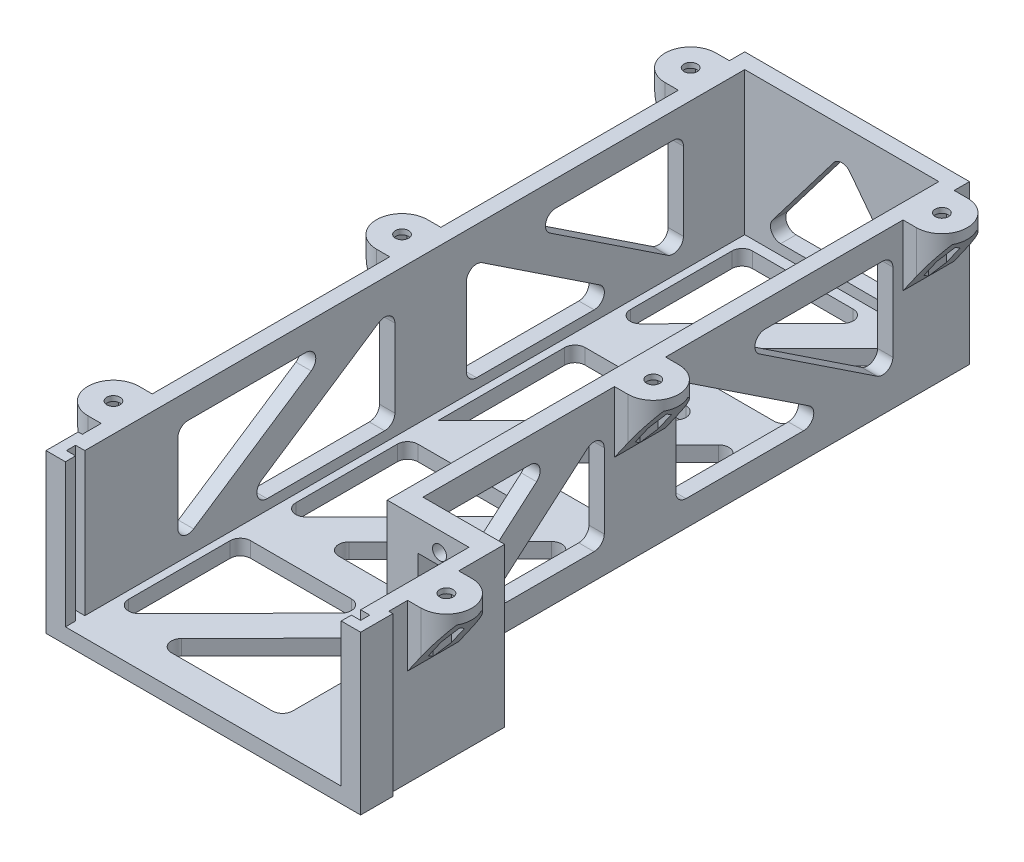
SolidWorks part; units mm, degrees
ref_plane "Front Plane" through (0, 0, 0) normal (0, 0, 1) x (1, 0, 0)
ref_plane "Top Plane" through (0, 0, 0) normal (0, 1, 0) x (1, 0, 0)
ref_plane "Right Plane" through (0, 0, 0) normal (1, 0, 0) x (0, 0, -1)
sketch "Sketch1" plane through (0, 0, 0) normal (0, 1, 0) x (1, 0, 0)
  line L0 (22, 68) -> (-22, 68)
  line L1 (19, 65) -> (-19, 65)
  line L2 (19, 65) -> (19, -65)
  line L3 (19, -65) -> (-19, -65) construction
  line L4 (-19, 65) -> (-19, -65)
  line L5 (19, 65) -> (-19, -65) construction
  line L6 (19, -65) -> (-19, 65) construction
  line L7 (-22, 68) -> (-22, -68)
  line L8 (22, -68) -> (-22, -68) construction
  line L9 (22, 68) -> (22, -68)
  line L10 (-19, -65) -> (-19, -68)
  line L11 (-19, -68) -> (-22, -68)
  line L12 (19, -65) -> (19, -68)
  line L13 (19, -68) -> (22, -68)
  point P0 (0, 0)
  dimension "D1" = 130
  dimension "D2" = 38
  dimension "D3" = 3
extrude "Boss-Extrude1" add sketch "Sketch1" along normal blind 28
sketch "Sketch2" plane through (0, 0, 0) normal (0, -1, 0) x (1, 0, 0)
  line L1 (-22, 68) -> (22, 68)
  line L2 (-22, 68) -> (-22, -68)
  line L3 (-22, -68) -> (22, -68)
  line L4 (22, 68) -> (22, -68)
extrude "Boss-Extrude2" add sketch "Sketch2" along normal blind 3
sketch "Sketch3" plane through (22, 0, 0) normal (1, 0, 0) x (0, 0, -1)
  line L0 (-68, 28) -> (-68, 0)
  line L3 (-43, 28) -> (-43, 0)
  line L8 (-68, 28) -> (68, 28) construction
  line L9 (-68, 28) -> (-43, 28)
  line L10 (-68, 0) -> (-43, 0)
  dimension "D3" = 25
extrude "Cut-Extrude1" cut sketch "Sketch3" against normal up to surface (3 mm away)
ref_plane "Plane1" through (0, 0, 43) normal (0, 0, -1) x (-1, 0, 0)
sketch "Sketch5" plane through (0, 0, 43) normal (0, 0, -1) x (-1, 0, 0)
  line L0 (-22, 12.5) -> (22, 12.5) construction
  line L1 (-22, 28) -> (-38, 28)
  line L2 (-22, 28) -> (-22, -3)
  line L3 (-22, -3) -> (-38, -3)
  line L4 (-38, 28) -> (-38, -3)
  line L5 (-29.25, 24.25) -> (-29.25, 3.75) construction
  line L6 (-25, 6) -> (-33.5, 6)
  line L7 (-25, 6) -> (-25, 22)
  line L8 (-25, 22) -> (-33.5, 22)
  line L9 (-33.5, 6) -> (-33.5, 22)
  line L10 (-25, 6) -> (-33.5, 22) construction
  line L11 (-25, 22) -> (-33.5, 6) construction
  line L12 (22, 28) -> (22, -3) construction
  circle A0 centre (-29.25, 24.25) radius 1.375
  circle A1 centre (-29.25, 3.75) radius 1.375
  point P12 (-29.25, 14)
  point P13 (-29.25, 14)
  dimension "D3" = 2.75
  dimension "D1" = 16
  dimension "D2" = 20.5
  dimension "D4" = 8.5
  dimension "D5" = 16
  dimension "D6" = 7.25
  dimension "D7" = 1.5
extrude "Boss-Extrude3" add sketch "Sketch5" along normal blind 4
sketch "Sketch6" plane through (0, 0, 43) normal (0, 0, 1) x (1, 0, 0)
  line L0 (38, 28) -> (38, -3)
  line L1 (38, -3) -> (22, -3)
  line L2 (22, -3) -> (22, 0)
  line L3 (22, 0) -> (35, 0)
  line L4 (35, 0) -> (35, 28)
  line L5 (19, 28) -> (38, 28) construction
  line L6 (35, 28) -> (38, 28)
  dimension "D1" = 3
extrude "Boss-Extrude4" add sketch "Sketch6" along normal up to surface (25 mm away)
sketch "Sketch7" plane through (0, 28, 0) normal (0, 1, 0) x (1, 0, 0)
  line L0 (-24.5981, -48) -> (-24.5981, -58) construction
  line L1 (-24.5981, -48) -> (-19, -48)
  line L2 (-24.5981, -58) -> (-19, -58)
  line L3 (-19, -48) -> (-19, -58)
  line L5 (-19, -68) -> (-19, 65) construction
  line L6 (-23.299, -50.75) -> (-25.8971, -50.75)
  line L7 (-25.8971, -50.75) -> (-27.1962, -53)
  line L8 (-27.1962, -53) -> (-25.8971, -55.25)
  line L9 (-25.8971, -55.25) -> (-23.299, -55.25)
  line L10 (-23.299, -55.25) -> (-22, -53)
  line L11 (-22, -53) -> (-23.299, -50.75)
  line L12 (-19, -68) -> (-19, 65) construction
  line L13 (-22, 68) -> (-22, -68) construction
  line L14 (-22, -68) -> (-19, -68) construction
  line L15 (-24.5981, 8.5) -> (-19, 8.5)
  line L16 (-24.5981, -1.5) -> (-19, -1.5)
  line L17 (-19, 8.5) -> (-19, -1.5)
  line L18 (-23.299, 5.75) -> (-25.8971, 5.75)
  line L19 (-25.8971, 5.75) -> (-27.1962, 3.5)
  line L20 (-27.1962, 3.5) -> (-25.8971, 1.25)
  line L21 (-25.8971, 1.25) -> (-23.299, 1.25)
  line L22 (-23.299, 1.25) -> (-22, 3.5)
  line L23 (-22, 3.5) -> (-23.299, 5.75)
  line L24 (-24.5981, 8.5) -> (-24.5981, -1.5) construction
  line L25 (-24.5981, 65) -> (-19, 65)
  line L26 (-24.5981, 55) -> (-19, 55)
  line L27 (-19, 65) -> (-19, 55)
  line L28 (-23.299, 62.25) -> (-25.8971, 62.25)
  line L29 (-25.8971, 62.25) -> (-27.1962, 60)
  line L30 (-27.1962, 60) -> (-25.8971, 57.75)
  line L31 (-25.8971, 57.75) -> (-23.299, 57.75)
  line L32 (-23.299, 57.75) -> (-22, 60)
  line L33 (-22, 60) -> (-23.299, 62.25)
  line L34 (-24.5981, 65) -> (-24.5981, 55) construction
  line L35 (8, -68) -> (8, -51.9857) construction
  line L36 (35, -68) -> (-19, -68) construction
  line L37 (40.5981, -48) -> (40.5981, -58) construction
  line L38 (38, -53) -> (39.299, -50.75)
  line L39 (39.299, -55.25) -> (38, -53)
  line L40 (41.8971, -55.25) -> (39.299, -55.25)
  line L41 (43.1962, -53) -> (41.8971, -55.25)
  line L42 (41.8971, -50.75) -> (43.1962, -53)
  line L43 (39.299, -50.75) -> (41.8971, -50.75)
  line L44 (35, -48) -> (35, -58)
  line L45 (40.5981, -58) -> (35, -58)
  line L46 (40.5981, -48) -> (35, -48)
  line L47 (35, -68) -> (35, -43) construction
  line L48 (0, 0) -> (0, 65) construction
  line L49 (-19, 65) -> (19, 65) construction
  line L50 (24.5981, 65) -> (24.5981, 55) construction
  line L51 (24.5981, 8.5) -> (24.5981, -1.5) construction
  line L52 (22, 60) -> (23.299, 62.25)
  line L53 (23.299, 57.75) -> (22, 60)
  line L54 (25.8971, 57.75) -> (23.299, 57.75)
  line L55 (27.1962, 60) -> (25.8971, 57.75)
  line L56 (25.8971, 62.25) -> (27.1962, 60)
  line L57 (23.299, 62.25) -> (25.8971, 62.25)
  line L58 (19, 65) -> (19, 55)
  line L59 (24.5981, 55) -> (19, 55)
  line L60 (24.5981, 65) -> (19, 65)
  line L61 (22, 3.5) -> (23.299, 5.75)
  line L62 (23.299, 1.25) -> (22, 3.5)
  line L63 (25.8971, 1.25) -> (23.299, 1.25)
  line L64 (27.1962, 3.5) -> (25.8971, 1.25)
  line L65 (25.8971, 5.75) -> (27.1962, 3.5)
  line L66 (23.299, 5.75) -> (25.8971, 5.75)
  line L67 (19, 8.5) -> (19, -1.5)
  line L68 (24.5981, -1.5) -> (19, -1.5)
  line L69 (24.5981, 8.5) -> (19, 8.5)
  arc A0 (-24.5981, -48) -> (-24.5981, -58) centre (-24.5981, -53) ccw
  circle A3 centre (-24.5981, -53) radius 2.25 construction
  arc A4 (-24.5981, 8.5) -> (-24.5981, -1.5) centre (-24.5981, 3.5) ccw
  circle A5 centre (-24.5981, 3.5) radius 2.25 construction
  arc A6 (-24.5981, 65) -> (-24.5981, 55) centre (-24.5981, 60) ccw
  circle A7 centre (-24.5981, 60) radius 2.25 construction
  circle A8 centre (40.5981, -53) radius 2.25 construction
  arc A9 (40.5981, -48) -> (40.5981, -58) centre (40.5981, -53) cw
  circle A10 centre (24.5981, 60) radius 2.25 construction
  circle A11 centre (24.5981, 3.5) radius 2.25 construction
  arc A12 (24.5981, 65) -> (24.5981, 55) centre (24.5981, 60) cw
  arc A13 (24.5981, 8.5) -> (24.5981, -1.5) centre (24.5981, 3.5) cw
  point P7 (-24.5981, -53)
  dimension "D1" = 4.5
  dimension "D2" = 10
  dimension "D3" = 10
  dimension "D4" = 3
extrude "Boss-Extrude5" add sketch "Sketch7" against normal blind 2
sketch "Sketch8" plane through (0, 28, 0) normal (0, 1, 0) x (1, 0, 0)
  line L7 (-24.5981, 8.5) -> (-24.5981, -1.5) construction
  line L8 (-22, -53) -> (-23.299, -50.75)
  line L9 (-23.299, -55.25) -> (-22, -53)
  line L10 (-25.8971, -55.25) -> (-23.299, -55.25)
  line L11 (-27.1962, -53) -> (-25.8971, -55.25)
  line L12 (-25.8971, -50.75) -> (-27.1962, -53)
  line L13 (-23.299, -50.75) -> (-25.8971, -50.75)
  line L14 (-22, -53) -> (-23.299, -50.75)
  line L15 (-23.299, -55.25) -> (-22, -53)
  line L16 (-25.8971, -55.25) -> (-23.299, -55.25)
  line L17 (-27.1962, -53) -> (-25.8971, -55.25)
  line L18 (-25.8971, -50.75) -> (-27.1962, -53)
  line L19 (-23.299, -50.75) -> (-25.8971, -50.75)
  line L21 (39.299, -55.25) -> (41.8971, -55.25)
  line L22 (38, -53) -> (39.299, -55.25)
  line L23 (39.299, -50.75) -> (38, -53)
  line L24 (41.8971, -50.75) -> (39.299, -50.75)
  line L25 (43.1962, -53) -> (41.8971, -50.75)
  line L26 (41.8971, -55.25) -> (43.1962, -53)
  line L27 (39.299, -55.25) -> (41.8971, -55.25)
  line L28 (38, -53) -> (39.299, -55.25)
  line L29 (39.299, -50.75) -> (38, -53)
  line L30 (41.8971, -50.75) -> (39.299, -50.75)
  line L31 (43.1962, -53) -> (41.8971, -50.75)
  line L32 (41.8971, -55.25) -> (43.1962, -53)
  line L34 (-22, 3.5) -> (-23.299, 5.75)
  line L35 (-23.299, 1.25) -> (-22, 3.5)
  line L36 (-25.8971, 1.25) -> (-23.299, 1.25)
  line L37 (-27.1962, 3.5) -> (-25.8971, 1.25)
  line L38 (-25.8971, 5.75) -> (-27.1962, 3.5)
  line L39 (-23.299, 5.75) -> (-25.8971, 5.75)
  line L40 (-22, 3.5) -> (-23.299, 5.75)
  line L41 (-23.299, 1.25) -> (-22, 3.5)
  line L42 (-25.8971, 1.25) -> (-23.299, 1.25)
  line L43 (-27.1962, 3.5) -> (-25.8971, 1.25)
  line L44 (-25.8971, 5.75) -> (-27.1962, 3.5)
  line L45 (-23.299, 5.75) -> (-25.8971, 5.75)
  line L47 (-22, 60) -> (-23.299, 62.25)
  line L48 (-23.299, 57.75) -> (-22, 60)
  line L49 (-25.8971, 57.75) -> (-23.299, 57.75)
  line L50 (-27.1962, 60) -> (-25.8971, 57.75)
  line L51 (-25.8971, 62.25) -> (-27.1962, 60)
  line L52 (-23.299, 62.25) -> (-25.8971, 62.25)
  line L53 (-22, 60) -> (-23.299, 62.25)
  line L54 (-23.299, 57.75) -> (-22, 60)
  line L55 (-25.8971, 57.75) -> (-23.299, 57.75)
  line L56 (-27.1962, 60) -> (-25.8971, 57.75)
  line L57 (-25.8971, 62.25) -> (-27.1962, 60)
  line L58 (-23.299, 62.25) -> (-25.8971, 62.25)
  line L60 (22, 60) -> (23.299, 57.75)
  line L61 (23.299, 62.25) -> (22, 60)
  line L62 (25.8971, 62.25) -> (23.299, 62.25)
  line L63 (27.1962, 60) -> (25.8971, 62.25)
  line L64 (25.8971, 57.75) -> (27.1962, 60)
  line L65 (23.299, 57.75) -> (25.8971, 57.75)
  line L66 (22, 60) -> (23.299, 57.75)
  line L67 (23.299, 62.25) -> (22, 60)
  line L68 (25.8971, 62.25) -> (23.299, 62.25)
  line L69 (27.1962, 60) -> (25.8971, 62.25)
  line L70 (25.8971, 57.75) -> (27.1962, 60)
  line L71 (23.299, 57.75) -> (25.8971, 57.75)
  line L73 (22, 3.5) -> (23.299, 1.25)
  line L74 (23.299, 5.75) -> (22, 3.5)
  line L75 (25.8971, 5.75) -> (23.299, 5.75)
  line L76 (27.1962, 3.5) -> (25.8971, 5.75)
  line L77 (25.8971, 1.25) -> (27.1962, 3.5)
  line L78 (23.299, 1.25) -> (25.8971, 1.25)
  line L79 (22, 3.5) -> (23.299, 1.25)
  line L80 (23.299, 5.75) -> (22, 3.5)
  line L81 (25.8971, 5.75) -> (23.299, 5.75)
  line L82 (27.1962, 3.5) -> (25.8971, 5.75)
  line L83 (25.8971, 1.25) -> (27.1962, 3.5)
  line L84 (23.299, 1.25) -> (25.8971, 1.25)
  circle A0 centre (24.5981, 3.5) radius 1.3
  circle A1 centre (24.5981, 60) radius 1.3
  circle A2 centre (-24.5981, 60) radius 1.3
  circle A3 centre (-24.5981, 3.5) radius 1.3
  circle A4 centre (-24.5981, -53) radius 1.3
  circle A5 centre (40.5981, -53) radius 1.3
  dimension "D7" = 2.6
  dimension "D1" = 0
  dimension "D2" = 0
  dimension "D3" = 0
  dimension "D4" = 0
  dimension "D5" = 0
  dimension "D6" = 0
extrude "Boss-Extrude6" add sketch "Sketch8" against normal blind 1
chamfer "Chamfer1" distance 7 angle 55 7 edges at (38, 26, 50.5) (38, 26, 55.5) (22, 26, -6) (22, 26, -57.5) (-22, 26, 55.5) (-22, 26, -57.5) (-22, 26, -1)
sketch "Sketch13" plane through (0, 28, 0) normal (0, 1, 0) x (1, 0, 0)
  line L0 (8, -68) -> (8, 68) construction
  line L2 (22, 68) -> (-22, 68) construction
  line L3 (-20.8, -64.2) -> (-19, -64.2) construction
  line L5 (-19, -68) -> (-19, 65) construction
  line L6 (-19, -64.2) -> (-19, -66) construction
  line L7 (-19, -66) -> (-20.8, -66) construction
  line L8 (-20.8, -66) -> (-20.8, -64.2) construction
  line L10 (-19, -68) -> (-19, 65) construction
  line L12 (-22, -68) -> (-19, -68) construction
  line L24 (35, -68) -> (-19, -68) construction
  line L25 (38.8, -68) -> (38.8, -61.7)
  line L26 (-22, -68) -> (-22.8, -68)
  line L27 (-22, -68) -> (-22, -61.7)
  line L28 (-22, -61.7) -> (-22.8, -61.7)
  line L29 (-22.8, -68) -> (-22.8, -61.7)
  line L30 (38, -61.7) -> (38.8, -61.7)
  line L31 (38, -68) -> (38, -61.7)
  line L32 (38, -68) -> (38.8, -68)
  dimension "D4" = 2
  dimension "D5" = 2.5
  dimension "D1" = 1.8
  dimension "D2" = 1.8
  dimension "D3" = 2
extrude "Boss-Extrude7" add sketch "Sketch13" against normal up to surface (31 mm away)
sketch "Sketch14" plane through (0, 28, 0) normal (0, 1, 0) x (1, 0, 0)
  line L0 (-20.8, -66) -> (-20.8, -64.2) construction
  line L1 (-19, -66) -> (-20.8, -66) construction
  line L2 (-19, -64.2) -> (-19, -66) construction
  line L3 (-20.8, -64.2) -> (-19, -64.2) construction
  line L4 (-20.8, -66) -> (-20.8, -64.2)
  line L5 (-19, -66) -> (-20.8, -66)
  line L6 (-19, -64.2) -> (-19, -66)
  line L7 (-20.8, -64.2) -> (-19, -64.2)
  line L8 (8, -68) -> (8, -80.6962) construction
  line L9 (35, -68) -> (-19, -68) construction
  line L10 (36.8, -64.2) -> (35, -64.2)
  line L11 (35, -64.2) -> (35, -66)
  line L12 (35, -66) -> (36.8, -66)
  line L13 (36.8, -66) -> (36.8, -64.2)
extrude "Cut-Extrude6" cut sketch "Sketch14" against normal up to surface (28 mm away)
sketch "Sketch9" plane through (0, -3, 0) normal (0, -1, 0) x (1, 0, 0)
  line L0 (-17.5, -63) -> (-17.5, -36.25)
  line L1 (-17.5, -36.25) -> (9.0469, -63)
  line L2 (9.0469, -63) -> (-17.5, -63)
  line L3 (-9.0469, -36.25) -> (17.5, -36.25)
  line L4 (17.5, -36.25) -> (17.5, -63)
  line L5 (17.5, -63) -> (-9.0469, -36.25)
  line L6 (-19, -65) -> (19, -65) construction
  line L7 (-19, 68) -> (-19, 66) construction
  line L8 (19, -65) -> (19, 43) construction
  line L9 (-17.5, -30.25) -> (-17.5, -3.5)
  line L10 (-17.5, -3.5) -> (9.0469, -30.25)
  line L11 (9.0469, -30.25) -> (-17.5, -30.25)
  line L12 (-9.0469, -3.5) -> (17.5, -3.5)
  line L13 (17.5, -3.5) -> (17.5, -30.25)
  line L14 (17.5, -30.25) -> (-9.0469, -3.5)
  line L15 (-17.5, 2.5) -> (-17.5, 29.25)
  line L16 (-17.5, 29.25) -> (9.0469, 2.5)
  line L17 (9.0469, 2.5) -> (-17.5, 2.5)
  line L18 (-9.0469, 29.25) -> (17.5, 29.25)
  line L19 (17.5, 29.25) -> (17.5, 2.5)
  line L20 (17.5, 2.5) -> (-9.0469, 29.25)
  line L21 (-17.5, 35.25) -> (-17.5, 62)
  line L22 (-17.5, 62) -> (9.0469, 35.25)
  line L23 (9.0469, 35.25) -> (-17.5, 35.25)
  line L24 (-9.0469, 62) -> (17.5, 62)
  line L25 (17.5, 62) -> (17.5, 35.25)
  line L26 (17.5, 35.25) -> (-9.0469, 62)
  line L27 (38.8, 68) -> (-22.8, 68) construction
  dimension "D1" = 2
  dimension "D2" = 1.5
  dimension "D3" = 1.5
  dimension "D4" = 6
  dimension "D6" = 6
  dimension "D7" = 6
  dimension "D5" = 4
extrude "Cut-Extrude2" cut sketch "Sketch9" against normal up to surface (3 mm away)
sketch "Sketch10" plane through (-22, 0, 0) normal (-1, 0, 0) x (0, 0, 1)
  line L0 (-53, 23) -> (-21.3519, 23)
  line L1 (-21.3519, 23) -> (-53, 2)
  line L2 (-53, 2) -> (-53, 23)
  line L3 (-42.1481, 2) -> (-10.5, 23)
  line L4 (-10.5, 23) -> (-10.5, 2)
  line L5 (-10.5, 2) -> (-42.1481, 2)
  line L6 (-55, 19.7134) -> (-55, 16.003) construction
  line L7 (-8.5, 16.003) -> (-8.5, 19.7134) construction
  line L8 (68, 0) -> (66, 0) construction
  line L9 (-55, 28) -> (-8.5, 28) construction
  line L10 (-3.5, 28) -> (-3.5, -3) construction
  line L11 (1.5, 28) -> (-8.5, 28) construction
  line L12 (61.7, -3) -> (-68, -3) construction
  line L13 (3.5, 2) -> (35.1481, 2)
  line L14 (3.5, 23) -> (3.5, 2)
  line L15 (35.1481, 2) -> (3.5, 23)
  line L16 (46, 2) -> (46, 23)
  line L17 (14.3519, 23) -> (46, 2)
  line L18 (46, 23) -> (14.3519, 23)
  dimension "D1" = 2
  dimension "D2" = 2
  dimension "D3" = 2
  dimension "D4" = 5
  dimension "D5" = 6
extrude "Cut-Extrude3" cut sketch "Sketch10" against normal up to surface (3 mm away)
sketch "Sketch11" plane through (22, 0, 0) normal (1, 0, 0) x (0, 0, -1)
  line L0 (10.5, 2) -> (42.1481, 2) construction
  line L1 (10.5, 23) -> (10.5, 2) construction
  line L2 (42.1481, 2) -> (10.5, 23) construction
  line L3 (10.5, 2) -> (42.1481, 2)
  line L4 (10.5, 23) -> (10.5, 2)
  line L5 (42.1481, 2) -> (10.5, 23)
  line L6 (53, 23) -> (21.3519, 23) construction
  line L7 (53, 2) -> (53, 23) construction
  line L8 (21.3519, 23) -> (53, 2) construction
  line L9 (53, 23) -> (21.3519, 23)
  line L10 (53, 2) -> (53, 23)
  line L11 (21.3519, 23) -> (53, 2)
  line L12 (-3.5, 23) -> (-3.5, 2)
  line L13 (-3.5, 2) -> (-27.8195, 2)
  line L14 (-27.8195, 2) -> (-3.5, 23)
  line L15 (-37, 2) -> (-12.6805, 23)
  line L16 (-12.6805, 23) -> (-37, 23)
  line L17 (-37, 23) -> (-37, 2)
  line L18 (3.5, 16.003) -> (3.5, -3) construction
  line L19 (68, -3) -> (-39, -3) construction
  line L20 (-3.5, 2) -> (10.5, 2) construction
  line L22 (-39, 28) -> (-39, -3) construction
  point P11 (3.5, 2)
  dimension "D1" = 6
  dimension "D2" = 2
extrude "Cut-Extrude4" cut sketch "Sketch11" against normal up to surface (3 mm away)
sketch "Sketch12" plane through (0, 0, -68) normal (0, 0, -1) x (-1, 0, 0)
  line L0 (16, 2) -> (-16, 2)
  line L1 (-16, 2) -> (0, 23)
  line L2 (0, 23) -> (16, 2)
  line L3 (22, -3) -> (-22, -3) construction
  line L4 (-22, 28) -> (22, 28) construction
  line L5 (22, 28) -> (22, -3) construction
  point P3 (0, 2)
  dimension "D1" = 5
  dimension "D2" = 5
  dimension "D3" = 6
extrude "Cut-Extrude5" cut sketch "Sketch12" against normal up to surface (3 mm away)
fillet "Fillet1" radius 2 50 edges at (-9.0469, -1.5, -36.25) (17.5, -1.5, -63) (17.5, -1.5, -36.25) (9.0469, -1.5, -63) (-17.5, -1.5, -36.25) (-17.5, -1.5, -63) (-17.5, -1.5, -30.25) (9.0469, -1.5, -30.25) (17.5, -1.5, -30.25) (17.5, -1.5, -3.5) (-9.0469, -1.5, -3.5) (-17.5, -1.5, 2.5) (-17.5, -1.5, 29.25) (9.0469, -1.5, 2.5) (17.5, -1.5, 2.5) (17.5, -1.5, 29.25) (-9.0469, -1.5, 29.25) (17.5, -1.5, 62) (-9.0469, -1.5, 62) (17.5, -1.5, 35.25) (9.0469, -1.5, 35.25) (-17.5, -1.5, 35.25) (-17.5, -1.5, 62) (20.5, 23, -10.5) (20.5, 2, -42.1481) (0, 23, -66.5) (16, 2, -66.5) (-16, 2, -66.5) (20.5, 23, -53) (20.5, 2, -53) (20.5, 23, -21.3519) (20.5, 2, -10.5) (20.5, 2, 37) (20.5, 23, 37) (20.5, 23, 12.6805) (20.5, 23, 3.5) (20.5, 2, 3.5) (20.5, 2, 27.8195) (-20.5, 23, 14.3519) (-20.5, 23, 46) (-20.5, 2, 46) (-20.5, 2, 35.1481) (-20.5, 2, 3.5) (-20.5, 23, 3.5) (-20.5, 2, -42.1481) (-20.5, 23, -10.5) (-20.5, 2, -10.5) (-20.5, 23, -21.3519) (-20.5, 23, -53) (-20.5, 2, -53)
ref_plane "Assembly midplane" through (8, 0, 0) normal (-1, 0, 0) x (0, 0, 1)
